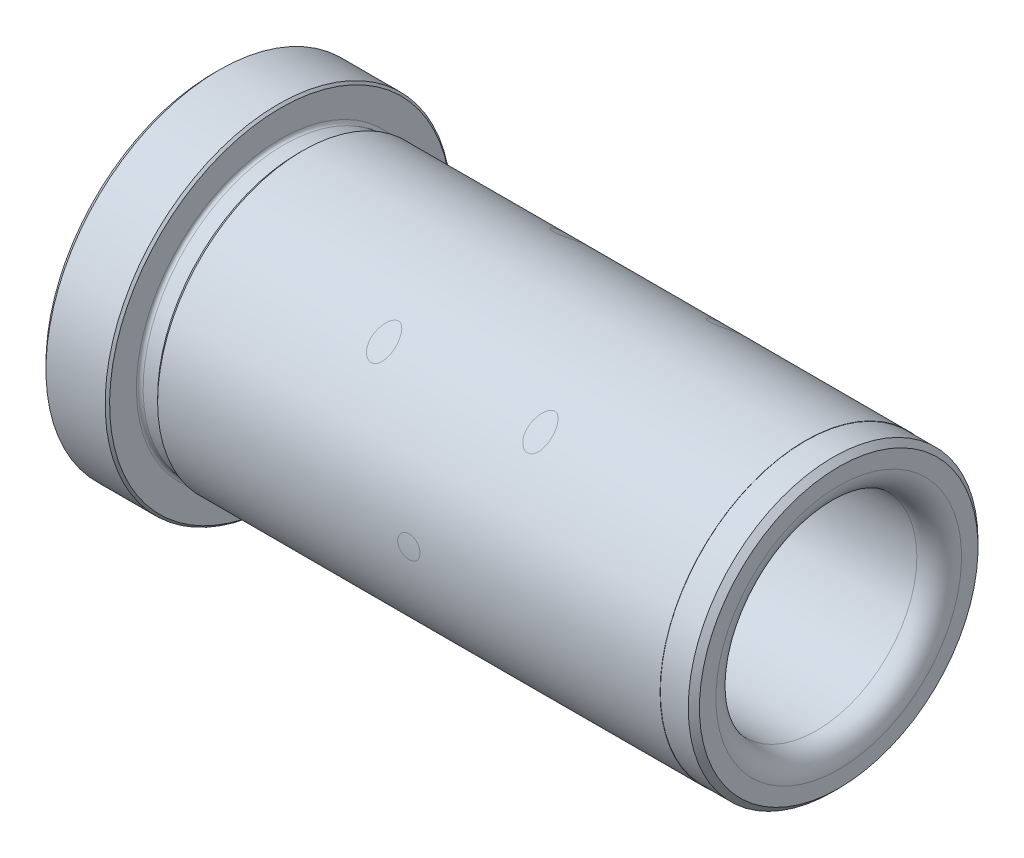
SolidWorks part; units mm, degrees
ref_plane "Front Plane" through (0, 0, 0) normal (0, 0, 1) x (1, 0, 0)
ref_plane "Top Plane" through (0, 0, 0) normal (0, 1, 0) x (1, 0, 0)
ref_plane "Right Plane" through (0, 0, 0) normal (1, 0, 0) x (0, 0, -1)
sketch "Sketch1" plane through (0, 0, 0) normal (0, 0, 1) x (1, 0, 0)
  line L0 (28, 12.975) -> (25, 12.975)
  line L1 (25, 13) -> (-20, 13)
  line L2 (25, 12.975) -> (25, 13)
  line L6 (-22, 15.5) -> (-22, 12.9)
  line L7 (-22, 15.5) -> (-28, 15.5)
  line L8 (-28, 15.5) -> (-28, 0)
  line L13 (28, 12.975) -> (28, 0)
  line L14 (28, 0) -> (-28, 0) construction
  line L15 (28, 0) -> (-28, 0)
  line L16 (-20, 13) -> (-20.4, 12.6)
  line L17 (-20.4, 12.6) -> (-21.7, 12.6)
  arc A0 (-21.7, 12.6) -> (-22, 12.9) centre (-21.7, 12.9) cw
  point P16 (0, 0)
  dimension "D5" = 0.025
  dimension "D1" = 0.3
  dimension "D2" = 135
  dimension "OD" = 26
  dimension "D3" = 0.4
  dimension "T" = 6
  dimension "HeadDia" = 31
  dimension "S" = 56
  dimension "HeadGap" = 2
  dimension "LeadLength" = 3
revolve "Revolve1" add sketch "Sketch1" angle 360 about L14
sketch "Sketch2" plane through (28, 0, 0) normal (1, 0, 0) x (0, 0, -1)
  circle A0 centre (0, 0) radius 9
  circle A1 centre (0, 0) radius 13 construction
  dimension "ID" = 18
extrude "Extrude1" cut sketch "Sketch2" against normal blind 56
sketch "Sketch4" [suppressed] plane through (-48, 0, 0) normal (1, 0, 0) x (0, 0, -1)
  circle A0 centre (0, 0) radius 21.01
  circle A2 centre (0, 0) radius 21 construction
  dimension "D1" = 0.01
extrude "Extrude3" [suppressed] cut sketch "Sketch4" against normal through all
fillet "Fillet2" radius 2 1 edges at (28, 9, 0)
chamfer "Chamfer5" distance 0.2 angle 45 1 edges at (-22, 15.5, 0)
chamfer "Chamfer3" distance 0.5 angle 45 1 edges at (28, 12.975, 0)
chamfer "Chamfer4" distance 0.5 angle 45 1 edges at (-28, 15.5, 0)
chamfer "Chamfer6" [suppressed] distance 0.5 angle 45
chamfer "Chamfer7" distance 0.5 angle 45 1 edges at (-28, 9, 0)
sketch "Sketch5" plane through (0, 0, 0) normal (0, 0, 1) x (1, 0, 0)
  line L0 (-20, 0) -> (25, 0) construction
  line L1 (-20, 13) -> (-20, -13) construction
  line L2 (25, -13) -> (25, 13) construction
  line L3 (2.5, 0) -> (2.5, 11.6457) construction
  circle A0 centre (2.5, 0) radius 1 construction
  circle A1 centre (-4.5, 10) radius 1
  circle A2 centre (9.5, 10) radius 1 construction
  circle A3 centre (-4.5, -10) radius 1 construction
  circle A4 centre (9.5, -10) radius 1 construction
  dimension "D1" = 2
  dimension "D2" = 7
  dimension "D3" = 10
sketch "Sketch6" plane through (0, 0, 0) normal (0, 0, 1) x (1, 0, 0)
  circle A0 centre (9.5, 10) radius 1 construction
  circle A1 centre (9.5, 10) radius 1
sketch "Sketch7" plane through (0, 0, 0) normal (0, 0, 1) x (1, 0, 0)
  circle A0 centre (-4.5, -10) radius 1 construction
  circle A1 centre (-4.5, -10) radius 1
sketch "Sketch8" plane through (0, 0, 0) normal (0, 0, 1) x (1, 0, 0)
  circle A0 centre (9.5, -10) radius 1 construction
  circle A1 centre (9.5, -10) radius 1
sketch "Sketch10" plane through (0, 0, 0) normal (0, 0, 1) x (1, 0, 0)
  circle A0 centre (2.5, 0) radius 1 construction
  circle A1 centre (2.5, 0) radius 1
